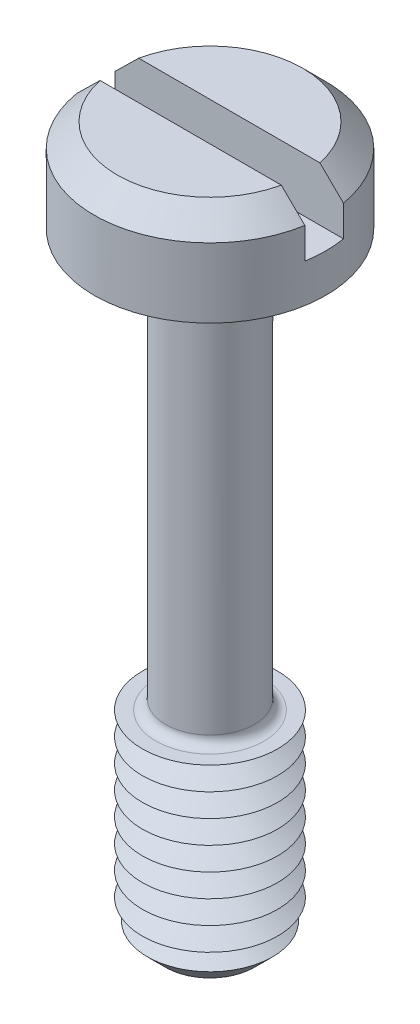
SolidWorks part; units mm, degrees
ref_plane "Front Plane" through (0, 0, 0) normal (0, 0, 1) x (1, 0, 0)
ref_plane "Top Plane" through (0, 0, 0) normal (0, 1, 0) x (1, 0, 0)
ref_plane "Right Plane" through (0, 0, 0) normal (1, 0, 0) x (0, 0, -1)
sketch "Sketch1" plane through (0, 0, 0) normal (0, 1, 0) x (1, 0, 0)
  circle A0 centre (0, 0) radius 3
  dimension "D1" = 6
extrude "Boss-Extrude1" add sketch "Sketch1" along normal blind 2.4
sketch "Sketch2" plane through (0, 0, 0) normal (0, -1, 0) x (1, 0, 0)
  circle A0 centre (0, 0) radius 1.15
  dimension "D1" = 2.3
extrude "Boss-Extrude2" add sketch "Sketch2" along normal blind 16
sketch "Sketch3" plane through (0, -16, 0) normal (0, -1, 0) x (1, 0, 0)
  circle A0 centre (0, 0) radius 1.75
  dimension "D1" = 3.5
extrude "Boss-Extrude3" add sketch "Sketch3" against normal blind 5.2
chamfer "Chamfer1" distance 0.6 angle 45 1 edges at (0, -16, -1.75)
sketch "Sketch4" plane through (0, 0, 0) normal (1, 0, 0) x (0, 0, -1)
  line L0 (0, -6.5871) -> (0, -12.0372) construction
sketch "Sketch5" plane through (0, 0, 0) normal (1, 0, 0) x (0, 0, -1)
  line L0 (-1.75, -10.8) -> (-1.2304, -11.1)
  line L1 (-1.2304, -11.1) -> (-1.75, -11.4)
  line L2 (-1.75, -10.8) -> (-1.75, -15.4) construction
  line L3 (-1.75, -11.4) -> (-1.75, -10.8)
  dimension "D1" = 0.6
revolve "Cut-Revolve1" cut sketch "Sketch5" angle 360 about L0
pattern_linear "LPattern1" count 8 spacing 0.6 along (0, -1, 0) of "Cut-Revolve1"
fillet "Fillet1" radius 0.25 2 edges at (0, -10.8, -1.15) (0, 0, -1.15)
chamfer "Chamfer2" distance 0.6 angle 45 1 edges at (0, 2.4, 3)
sketch "Sketch6" plane through (0, 2.4, 0) normal (0, 1, 0) x (1, 0, 0)
  line L1 (3, -0.5) -> (-3, -0.5)
  line L2 (3, -0.5) -> (3, 0.5)
  line L3 (3, 0.5) -> (-3, 0.5)
  line L4 (-3, -0.5) -> (-3, 0.5)
  line L5 (3, -0.5) -> (-3, 0.5) construction
  line L6 (3, 0.5) -> (-3, -0.5) construction
  circle A0 centre (0, 0) radius 3 construction
  point P0 (0, 0)
  dimension "D1" = 1
extrude "Cut-Extrude1" cut sketch "Sketch6" against normal blind 1.4
